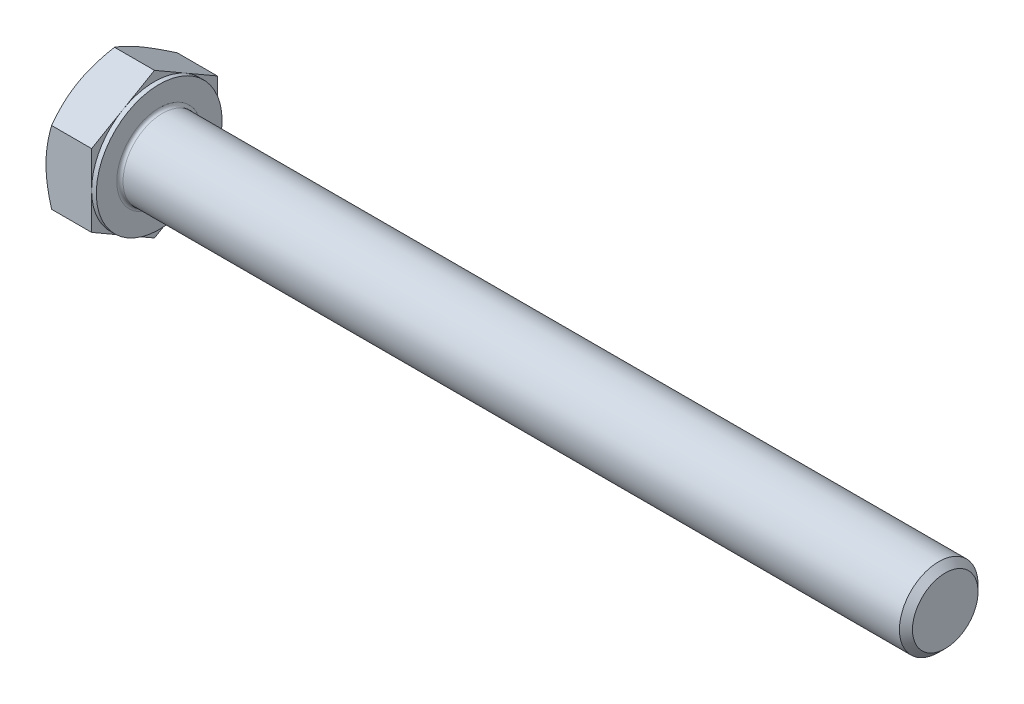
SolidWorks part; units mm, degrees
ref_plane "Plane1" through (0, 0, 0) normal (0, 0, 1) x (1, 0, 0)
ref_plane "Plane2" through (0, 0, 0) normal (0, 1, 0) x (1, 0, 0)
ref_plane "Plane3" through (0, 0, 0) normal (1, 0, 0) x (0, 0, -1)
sketch "Sketch1" plane through (0, 0, 0) normal (1, 0, 0) x (0, 0, -1)
  line L0 (8, 4.6188) -> (8, -4.6188)
  line L1 (-8, 4.6188) -> (-8, -4.6188)
  line L2 (8, -4.6188) -> (0, -9.2376)
  line L3 (0, -9.2376) -> (-8, -4.6188)
  line L4 (8, 4.6188) -> (0, 9.2376)
  line L5 (0, 9.2376) -> (-8, 4.6188)
  dimension "Width_flats" = 16
  dimension "D2" = 120
  dimension "D3" = 8
  dimension "D4" = 8
  dimension "D5" = 8
extrude "BaseHead" add sketch "Sketch1" along normal blind 6.4
sketch "BodySke" plane through (0, 0, 0) normal (0, 0, 1) x (1, 0, 0)
  line L0 (0, 4.6188) -> (0, -4.6188) construction
  line L1 (0, 0) -> (106.4, 0)
  line L2 (0, 0) -> (0, 5)
  line L3 (0, 5) -> (105.572, 5)
  line L4 (106.4, 0) -> (106.4, 4.172)
  line L5 (6.4, 9.2376) -> (6.4, 4.6188) construction
  line L6 (106.4, 4.172) -> (105.572, 5)
  line L7 (0, 0) -> (96.52, 0) construction
  line L8 (106.4, -4.172) -> (105.572, -5) construction
  line L9 (0, -5) -> (105.572, -5) construction
  line L10 (7.9, 15.24) -> (7.9, -1.27) construction
  line L11 (80.4, 15.24) -> (80.4, -1.27) construction
  line L12 (6.4, 4.6188) -> (6.4, -4.6188) construction
  dimension "Length" = 100
  dimension "Body_ch_ang" = 45
  dimension "Diameter" = 10
  dimension "Minor_dia" = 8.344
  dimension "Advance" = 1.5
  dimension "Thread_nom" = 26
revolve "BaseBody" add sketch "BodySke"
fillet "HeadFillet" radius 0.4 1 edges at (6.4, 0, -5)
sketch "Sketch3" plane through (0, 0, 0) normal (0, 0, 1) x (1, 0, 0)
  line L0 (0, 8) -> (3.6013, 14.2376)
  line L1 (0, 9.2376) -> (0, 4.6188) construction
  line L2 (3.6013, 14.2376) -> (3.6013, 19.2376)
  line L3 (3.6013, 19.2376) -> (-10, 19.2376)
  line L4 (-10, 19.2376) -> (-10, 8)
  line L5 (-10, 8) -> (0, 8)
  line L6 (0, 0) -> (99.06, 0) construction
  line L7 (6.4, 9.2376) -> (0, 9.2376) construction
  dimension "D1" = 8
  dimension "D2" = 5
  dimension "D3" = 10
  dimension "D4" = 5
  dimension "Head_ch_ang" = 30
revolve "HeadChamfer" cut sketch "Sketch3" angle 360 about L6
sketch "Sketch4" plane through (0, 0, 0) normal (0, 0, 1) x (1, 0, 0)
  line L1 (6.4, 9.2376) -> (6.4, 4.6188) construction
  line L2 (6.4, 8) -> (5.8, 8)
  line L3 (6.4, 8) -> (6.4, 19.2376)
  line L4 (6.4, 19.2376) -> (5.8, 19.2376)
  line L5 (0, 0) -> (95.25, 0) construction
  line L6 (0, 0) -> (96.52, 0) construction
  line L7 (5.8, 8) -> (5.8, 19.2376)
  line L8 (6.4, 9.2376) -> (0.7145, 9.2376) construction
  dimension "D1" = 16
  dimension "D2" = 10
  dimension "Bearing_ht" = 0.6
revolve "BearingFace" cut sketch "Sketch4" angle 360 about L5
sketch "ThdSchSke" plane through (0, 0, 0) normal (0, 0, 1) x (1, 0, 0)
  line L0 (80.4, -4.172) -> (79.8202, -5)
  line L1 (80.4, -4.172) -> (80.9798, -5)
  line L2 (80.9798, -5) -> (80.9798, -6.25)
  line L3 (-3.175, 0) -> (5.1513, 0) construction
  line L5 (80.9798, -6.25) -> (79.8202, -6.25)
  line L6 (79.8202, -6.25) -> (79.8202, -5)
  dimension "Thread_minor" = 8.344
  dimension "Diameter" = 10
  dimension "Start" = 80.4
  dimension "SideAngle" = 55
  dimension "VeeAngle" = 70
  dimension "Overcut" = 12.5
revolve "ThreadSchematic" [suppressed] cut sketch "ThdSchSke" angle 360 about L3
pattern_linear "ThdSchPat" [suppressed]
equation "\"D3@Sketch1\" = \"Width_flats@Sketch1\" / 2"
equation "\"D4@Sketch1\" = \"D3@Sketch1\""
equation "\"D5@Sketch1\" = \"D4@Sketch1\""
equation "\"Thread_minor@ThreadCosmetic\" = \"Minor_dia@BodySke\""
equation "\"D1@Sketch3\" = \"Width_flats@Sketch1\" / 2"
equation "\"D1@Sketch4\" = \"Width_flats@Sketch1\""
equation "\"Thread_length@ThreadCosmetic\" = ((sgn( (\"Length@BodySke\" - \"Advance@BodySke\" ) - \"Thread_nom@BodySke\" )-1)*( (\"Length@BodySke\" - \"Advance@BodySke\" ) - \"Thread_nom@BodySke\" ))/-2+ \"Thread_nom@BodySke\""
equation "\"Thread_minor@ThdSchSke\" = \"Minor_dia@BodySke\""
equation "\"Diameter@ThdSchSke\" = \"Diameter@BodySke\""
equation "\"Overcut@ThdSchSke\" = \"Diameter@BodySke\" * 1.25"
equation "\"Start@ThdSchSke\" = \"Head_ht@BaseHead\" + \"Length@BodySke\" - \"Thread_length@ThreadCosmetic\"  '---Non-countersunk---"
equation "\"Num_threads@ThdSchPat\" = int( \"Thread_length@ThreadCosmetic\" / \"Advance@BodySke\" + 0.999 )  + 1"
equation "\"Advance@ThdSchPat\" = \"Thread_length@ThreadCosmetic\" /  (\"Num_threads@ThdSchPat\" - 1) 'relax it"
equation "\"Num_threads@ThdSchPat\" = \"Num_threads@ThdSchPat\" - sgn( \"Num_threads@ThdSchPat\" - 1) '---chamfered tips only---"
